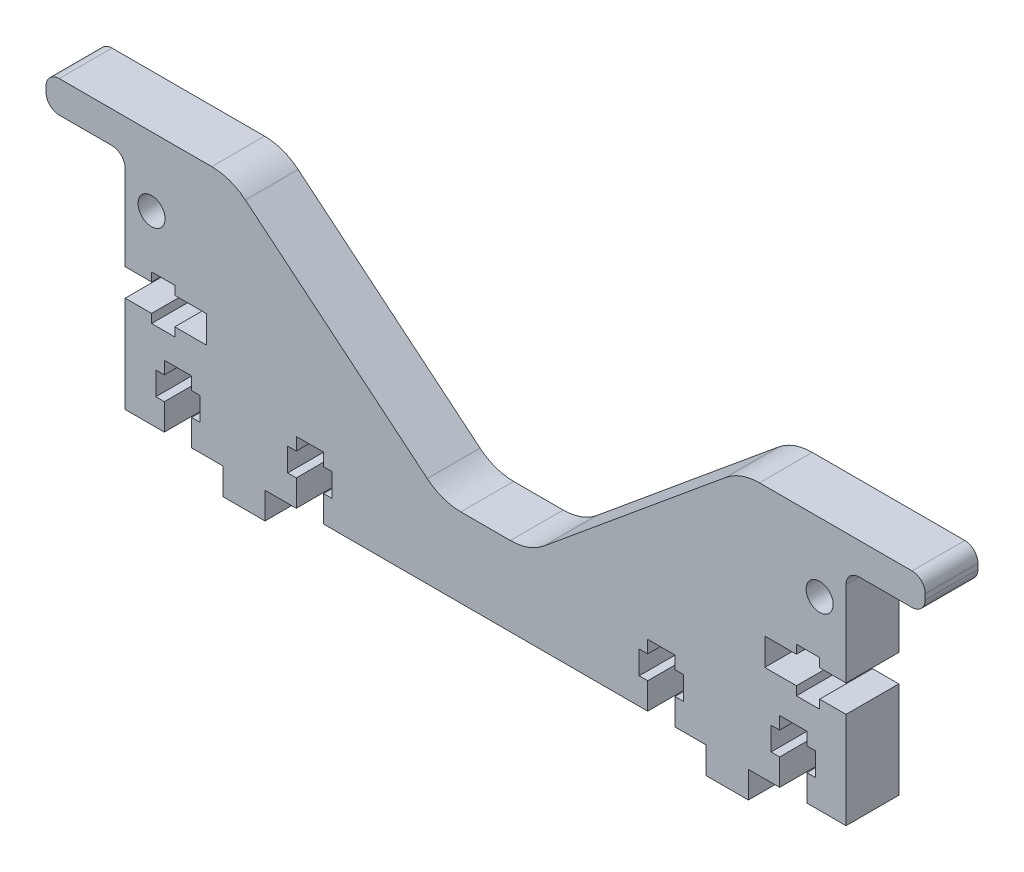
SolidWorks part; units mm, degrees
ref_plane "Front Plane" through (0, 0, 0) normal (0, 0, 1) x (1, 0, 0)
ref_plane "Top Plane" through (0, 0, 0) normal (0, 1, 0) x (1, 0, 0)
ref_plane "Right Plane" through (0, 0, 0) normal (1, 0, 0) x (0, 0, -1)
sketch "Sketch1" plane through (0, 0, 0) normal (0, 0, 1) x (1, 0, 0)
  line L0 (86.726, 0) -> (86.726, 53.4145)
  line L2 (0, -38.2429) -> (0, 108.2287) construction
  line L3 (86.726, 53.4145) -> (105.776, 53.4145)
  line L4 (61.326, 61.0345) -> (10.526, 19.05)
  line L5 (10.526, 19.05) -> (-10.526, 19.05)
  line L6 (86.726, 0) -> (-86.726, 0)
  line L8 (96.251, 53.3891) -> (96.251, 58.2151) construction
  line L9 (105.776, 53.4145) -> (105.776, 61.0345)
  line L10 (105.776, 61.0345) -> (61.326, 61.0345)
  line L11 (-61.326, 61.0345) -> (-10.526, 19.05)
  line L12 (-96.251, 53.3891) -> (-96.251, 58.2151) construction
  line L13 (-105.776, 61.0345) -> (-61.326, 61.0345)
  line L14 (-105.776, 53.4145) -> (-105.776, 61.0345)
  line L15 (-86.726, 53.4145) -> (-105.776, 53.4145)
  line L16 (-86.726, 0) -> (-86.726, 53.4145)
  point P29 (0, 19.05)
  point P32 (0, 0)
  dimension "D1" = 0.0254
  dimension "D2" = 7.62
  dimension "D3" = 19.05
  dimension "D4" = 25.4
  dimension "D5" = 19.05
  dimension "D6" = 50.8
  dimension "D7" = 173.452
  dimension "D8" = 53.4145
extrude "Boss-Extrude1" add sketch "Sketch1" against normal blind 12.7
sketch "Sketch2" plane through (-86.726, 0, 0) normal (-1, 0, 0) x (0, 0, 1)
  line L0 (-6.35, 0) -> (-6.35, 53.4145) construction
  line L1 (-12.7, 0) -> (0, 0) construction
  line L2 (-12.7, 53.4145) -> (0, 53.4145) construction
ref_plane "Plane1" through (0, 0, -6.35) normal (0, 0, 1) x (0, 1, 0)
fillet "Fillet1" radius 12.7 4 edges at (-61.326, 61.0345, -6.35) (-10.526, 19.05, -6.35) (10.526, 19.05, -6.35) (61.326, 61.0345, -6.35)
fillet "Fillet2" radius 3.175 6 edges at (-86.726, 53.4145, -6.35) (-105.776, 53.4145, -6.35) (-105.776, 61.0345, -6.35) (86.726, 53.4145, -6.35) (105.776, 53.4145, -6.35) (105.776, 61.0345, -6.35)
sketch "Sketch3" plane through (0, 0, 0) normal (0, 0, 1) x (1, 0, 0)
  line L0 (80.376, 0) -> (80.376, 61.0345) construction
  line L1 (-86.726, 0) -> (86.726, 0) construction
  line L2 (102.601, 61.0345) -> (65.8949, 61.0345) construction
  line L3 (86.726, 0) -> (86.726, 50.2395) construction
  line L4 (0, 0) -> (0, 19.05) construction
  line L5 (5.9571, 19.05) -> (-5.9571, 19.05) construction
  circle A0 centre (80.376, 44.5245) radius 3.25
  circle A1 centre (-80.376, 44.5245) radius 3.25
  point P12 (84.2479, 61.0345)
  dimension "D2" = 6.5
  dimension "D1" = 6.35
  dimension "D4" = 3.8719
  dimension "D5" = 16.51
extrude "Cut-Extrude1" cut sketch "Sketch3" against normal through all
sketch "Sketch4" plane through (0, 0, 0) normal (0, 0, 1) x (1, 0, 0)
  line L0 (86.726, 29.7567) -> (80.376, 29.7567)
  line L1 (86.726, 0) -> (86.726, 50.2395) construction
  line L2 (80.376, 29.7567) -> (80.376, 31.8649)
  line L3 (80.376, 31.8649) -> (74.788, 31.8649)
  line L4 (74.788, 31.8649) -> (74.788, 29.7567)
  line L5 (87.349, 26.4817) -> (65.603, 26.4817) construction
  line L6 (86.194, 26.4817) -> (88.504, 26.4817) construction
  line L7 (74.788, 29.7567) -> (67.168, 29.7567)
  line L8 (67.168, 29.7567) -> (67.168, 23.2067)
  line L9 (80.376, 22.1954) -> (80.376, 32.1954) construction
  line L10 (74.788, 23.2067) -> (67.168, 23.2067)
  line L11 (74.788, 21.0985) -> (74.788, 23.2067)
  line L12 (80.376, 21.0985) -> (74.788, 21.0985)
  line L13 (80.376, 23.2067) -> (80.376, 21.0985)
  line L14 (86.726, 23.2067) -> (80.376, 23.2067)
  line L15 (86.726, 29.7567) -> (86.726, 23.2067)
  line L16 (74.026, 0) -> (74.026, 16.2645) construction
  line L19 (77.3026, 0) -> (77.3026, 6.35)
  line L20 (-86.726, 0) -> (86.726, 0) construction
  line L21 (77.3026, 6.35) -> (79.36, 6.35)
  line L22 (79.36, 6.35) -> (79.36, 11.938)
  line L23 (79.36, 11.938) -> (77.3026, 11.938)
  line L24 (77.3026, 11.938) -> (77.3026, 14.986)
  line L25 (77.3026, 14.986) -> (70.7494, 14.986)
  line L26 (70.7494, 0) -> (70.7494, 6.35)
  line L27 (70.7494, 11.938) -> (70.7494, 14.986)
  line L28 (68.692, 11.938) -> (70.7494, 11.938)
  line L29 (68.692, 6.35) -> (68.692, 11.938)
  line L30 (70.7494, 6.35) -> (68.692, 6.35)
  line L31 (77.3026, 0) -> (70.7494, 0)
  line L32 (69.026, 6.35) -> (79.026, 6.35) construction
  line L33 (0, 0) -> (0, 77.6155) construction
  line L34 (-74.026, 0) -> (-74.026, 16.2645) construction
  line L35 (-87.349, 26.4817) -> (-65.603, 26.4817) construction
  line L36 (-77.3026, 0) -> (-70.7494, 0)
  line L37 (-70.7494, 6.35) -> (-68.692, 6.35)
  line L38 (-68.692, 6.35) -> (-68.692, 11.938)
  line L39 (-68.692, 11.938) -> (-70.7494, 11.938)
  line L40 (-70.7494, 11.938) -> (-70.7494, 14.986)
  line L41 (-70.7494, 0) -> (-70.7494, 6.35)
  line L42 (-77.3026, 14.986) -> (-70.7494, 14.986)
  line L43 (-77.3026, 11.938) -> (-77.3026, 14.986)
  line L44 (-79.36, 11.938) -> (-77.3026, 11.938)
  line L45 (-79.36, 6.35) -> (-79.36, 11.938)
  line L46 (-77.3026, 6.35) -> (-79.36, 6.35)
  line L47 (-77.3026, 0) -> (-77.3026, 6.35)
  line L48 (-86.726, 29.7567) -> (-86.726, 23.2067)
  line L49 (-86.726, 23.2067) -> (-80.376, 23.2067)
  line L50 (-80.376, 23.2067) -> (-80.376, 21.0985)
  line L51 (-80.376, 21.0985) -> (-74.788, 21.0985)
  line L52 (-74.788, 21.0985) -> (-74.788, 23.2067)
  line L53 (-74.788, 23.2067) -> (-67.168, 23.2067)
  line L54 (-67.168, 29.7567) -> (-67.168, 23.2067)
  line L55 (-74.788, 29.7567) -> (-67.168, 29.7567)
  line L56 (-74.788, 31.8649) -> (-74.788, 29.7567)
  line L57 (-80.376, 31.8649) -> (-74.788, 31.8649)
  line L58 (-80.376, 29.7567) -> (-80.376, 31.8649)
  line L59 (-86.726, 29.7567) -> (-80.376, 29.7567)
  line L60 (58.151, 0) -> (58.151, 22.5979) construction
  line L61 (38.9994, 0) -> (45.5526, 0)
  line L62 (45.5526, 6.35) -> (47.61, 6.35)
  line L63 (47.61, 6.35) -> (47.61, 11.938)
  line L64 (47.61, 11.938) -> (45.5526, 11.938)
  line L65 (45.5526, 11.938) -> (45.5526, 14.986)
  line L66 (45.5526, 0) -> (45.5526, 6.35)
  line L67 (38.9994, 14.986) -> (45.5526, 14.986)
  line L68 (38.9994, 11.938) -> (38.9994, 14.986)
  line L69 (36.942, 11.938) -> (38.9994, 11.938)
  line L70 (36.942, 6.35) -> (36.942, 11.938)
  line L71 (38.9994, 6.35) -> (36.942, 6.35)
  line L72 (38.9994, 0) -> (38.9994, 6.35)
  line L73 (42.276, 14.986) -> (42.276, 0) construction
  line L74 (-42.276, 14.986) -> (-42.276, 0) construction
  line L75 (-38.9994, 0) -> (-38.9994, 6.35)
  line L76 (-38.9994, 6.35) -> (-36.942, 6.35)
  line L77 (-36.942, 6.35) -> (-36.942, 11.938)
  line L78 (-36.942, 11.938) -> (-38.9994, 11.938)
  line L79 (-38.9994, 11.938) -> (-38.9994, 14.986)
  line L80 (-38.9994, 14.986) -> (-45.5526, 14.986)
  line L81 (-45.5526, 0) -> (-45.5526, 6.35)
  line L82 (-45.5526, 11.938) -> (-45.5526, 14.986)
  line L83 (-47.61, 11.938) -> (-45.5526, 11.938)
  line L84 (-47.61, 6.35) -> (-47.61, 11.938)
  line L85 (-45.5526, 6.35) -> (-47.61, 6.35)
  line L86 (-38.9994, 0) -> (-45.5526, 0)
  point P18 (67.168, 26.4817)
  point P37 (74.026, 14.986)
  point P74 (-74.026, 14.986)
  point P75 (-67.168, 26.4817)
  point P90 (42.276, 14.986)
  dimension "D1" = 3.275
  dimension "D2" = 2.1082
  dimension "D3" = 5.588
  dimension "D4" = 7.62
  dimension "D5" = 5.588
  dimension "D6" = 3.2766
  dimension "D7" = 5.334
  dimension "D8" = 3.048
  dimension "D9" = 31.75
  dimension "D10" = 28.575
extrude "Cut-Extrude2" cut sketch "Sketch4" against normal through all
sketch "Sketch6" plane through (0, 0, 0) normal (0, 0, 1) x (1, 0, 0)
  line L0 (-53.071, 0) -> (-53.071, -6.4008)
  line L1 (-70.7494, 0) -> (-45.5526, 0) construction
  line L2 (-53.071, -6.4008) -> (-63.231, -6.4008)
  line L3 (-63.231, -6.4008) -> (-63.231, 0)
  line L4 (-63.231, 0) -> (-53.071, 0)
  line L5 (-47.61, 9.144) -> (-68.692, 9.144) construction
  line L6 (-47.61, 11.938) -> (-47.61, 6.35) construction
  line L7 (-68.692, 6.35) -> (-68.692, 11.938) construction
  line L8 (-58.151, 9.144) -> (-58.151, 2.0953) construction
  line L9 (-58.151, -6.4008) -> (-58.151, 0) construction
  line L10 (0, 0) -> (0, 10.4728) construction
  line L11 (-38.9994, 0) -> (38.9994, 0) construction
  line L12 (58.151, -6.4008) -> (58.151, 0) construction
  line L13 (63.231, 0) -> (53.071, 0)
  line L14 (63.231, -6.4008) -> (63.231, 0)
  line L15 (53.071, -6.4008) -> (63.231, -6.4008)
  line L16 (53.071, 0) -> (53.071, -6.4008)
  dimension "D1" = 6.4008
  dimension "D2" = 10.16
extrude "Boss-Extrude2" add sketch "Sketch6" against normal blind 12.7
